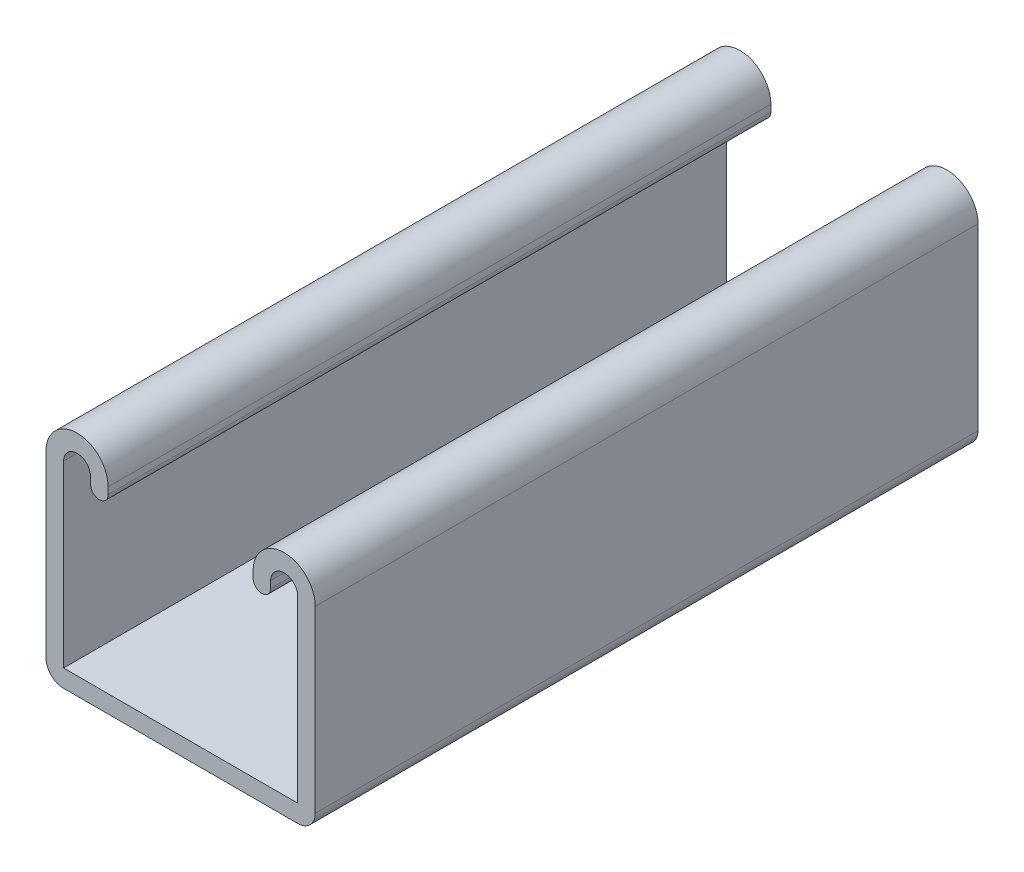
SolidWorks part; units mm, degrees
ref_plane "Plane1" through (0, 0, 0) normal (0, 0, 1) x (1, 0, 0)
ref_plane "Plane2" through (0, 0, 0) normal (0, 1, 0) x (1, 0, 0)
ref_plane "Plane3" through (0, 0, 0) normal (1, 0, 0) x (0, 0, -1)
sketch "Sketch1" plane through (0, 0, 0) normal (0, 0, 1) x (1, 0, 0)
  line L0 (-20.6375, 15.1511) -> (-20.6375, -12.319)
  line L1 (-17.9451, -15.0114) -> (17.9451, -15.0114)
  line L2 (20.6375, -12.319) -> (20.6375, 15.1511)
  line L3 (11.1125, 15.1511) -> (11.1125, 14.116)
  line L4 (-11.1125, 15.1511) -> (-11.1125, 14.116)
  line L5 (-13.8049, 15.1511) -> (-13.8049, 14.116)
  line L6 (-17.9451, 15.1511) -> (-17.9451, -12.319)
  line L7 (-17.9451, -12.319) -> (17.9451, -12.319)
  line L8 (17.9451, -12.319) -> (17.9451, 15.1511)
  line L9 (13.8049, 15.1511) -> (13.8049, 14.116)
  line L10 (-25.4, 19.9136) -> (25.4, 19.9136) construction
  line L11 (-12.8524, 12.7698) -> (12.8524, 12.7698) construction
  arc A0 (20.6375, 15.1511) -> (11.1125, 15.1511) centre (15.875, 15.1511) ccw
  arc A1 (-20.6375, 15.1511) -> (-11.1125, 15.1511) centre (-15.875, 15.1511) cw
  arc A2 (-17.9451, -15.0114) -> (-20.6375, -12.319) centre (-17.9451, -12.319) cw
  arc A3 (17.9451, -15.0114) -> (20.6375, -12.319) centre (17.9451, -12.319) ccw
  arc A4 (-17.9451, 15.1511) -> (-13.8049, 15.1511) centre (-15.875, 15.1511) cw
  arc A5 (17.9451, 15.1511) -> (13.8049, 15.1511) centre (15.875, 15.1511) ccw
  arc A6 (11.1125, 14.116) -> (13.8049, 14.116) centre (12.4587, 14.116) ccw
  arc A7 (-11.1125, 14.116) -> (-13.8049, 14.116) centre (-12.4587, 14.116) cw
  dimension "D1" = 2.6924
  dimension "D3" = 20.6375
  dimension "Width" = 41.275
  dimension "D5" = 15.0114
  dimension "D6" = 9.525
  dimension "D7" = 22.225
  dimension "D8" = 19.9136
  dimension "D9" = 7.1437
  dimension "gauge" = 2.6924
extrude "Base-Extrude" add sketch "Sketch1" along normal blind 101.6
other "Hole1"
sketch "Sketch3" plane through (0, -15.0114, 0) normal (0, -1, 0) x (1, 0, 0)
  circle A0 centre (0, 23.8125) radius 7.1438
  dimension "D1" = 14.2875
  dimension "D2" = 23.8125
pattern_linear "LPattern2" count 2 spacing 47.625 along (0, 0, 1) of "Hole1"
equation "\"D3@Sketch1\" = \"Width@Sketch1\" / 2"
equation "\"D7@Sketch1\" = \"Width@Sketch1\" - 2 * \"D6@Sketch1\""
equation "\"D1@Sketch1\" = \"gauge@Sketch1\""
equation "\"D1@LPattern2\" = \"D1@Base-Extrude\" / \"D3@LPattern2\""
